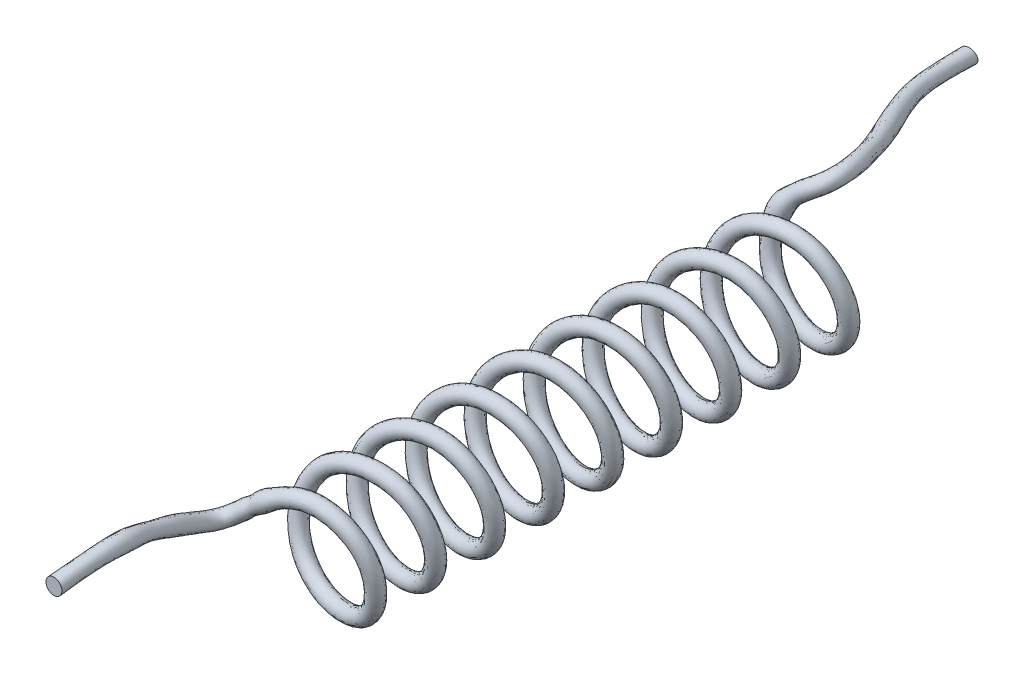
SolidWorks part; units mm, degrees
ref_plane "Plan de face" through (0, 0, 0) normal (0, 0, 1) x (1, 0, 0)
ref_plane "Plan de dessus" through (0, 0, 0) normal (0, 1, 0) x (1, 0, 0)
ref_plane "Plan de droite" through (0, 0, 0) normal (1, 0, 0) x (0, 0, -1)
sketch "Esquisse1" plane through (0, 0, 0) normal (0, 0, 1) x (1, 0, 0)
  circle A0 centre (0, 0) radius 1
curve "Hélice/Spirale1"
sketch3d "Esquisse3D3"
  spline S0 degree 3 poles (-0.7071, 0.7071, 10) (-0.8797, 0.5551, 10.0436) (-1.4291, 0.0713, 10.1825) (-1.1988, 1.0091, 11.7491) (-1.2605, 0.8185, 12.7587) (-1.2966, 0.7071, 13.3488) knots 0 0 0 0 0.159969 0.509031 1 1 1 1
  spline S2 degree 3 number of poles 147 (-0.7071, 0.7071, 0) -> (-0.7071, 0.7071, 10) construction
ref_plane "Plan2" through (0, 0, 13.3488) normal (0, 0, 1) x (1, 0, 0)
sketch "Esquisse3" plane through (0, 0, 13.3488) normal (0, 0, 1) x (1, 0, 0)
  circle A0 centre (-1.2966, 0.7071) radius 0.15
sketch3d "Esquisse3D4"
  spline S0 degree 3 poles (-0.7071, 0.7071, 0) (-0.5849, 0.7998, -0.0431) (-0.1505, 1.1291, -0.1962) (-0.633, 0.8325, -1.8747) (-1.4309, 0.7069, -2.8037) (-1.3471, 0.7123, -3.76) (-1.3328, 0.7132, -3.9229) knots 0 0 0 0 0.099392 0.353323 0.889804 1 1 1 1
  spline S1 degree 3 number of poles 147 (-0.7071, 0.7071, 0) -> (-0.7071, 0.7071, 10) construction
sketch3d "Esquisse3D5"
  spline S0 degree 3 number of poles 71 (-1.2966, 0.7071, 13.3488) -> (-1.3328, 0.7132, -3.9229)
  spline S1 degree 3 poles (-987.3946, -1429.1945, -980.7629) (48.035, 66.2863, 47.7632) (-2.3414, -3.6435, 3.977) (0.8009, 9.1523, 25.3519) (-29.8022, -107.6609, 0.8937) (478.9964, 1843.6221, 623.6193) knots -3.961135 -3.961135 -3.961135 -3.961135 0.159969 0.509031 9.683063 9.683063 9.683063 9.683063 only from (-0.7071, 0.7071, 10) to (-1.2966, 0.7071, 13.3488) construction
  spline S2 degree 3 number of poles 147 (-0.7071, 0.7071, 0) -> (-0.7071, 0.7071, 10) construction
  spline S3 degree 3 poles (1348.1829, 963.7805, 1119.1844) (-53.0392, -36.9938, -34.4153) (1.4755, 2.1288, 5.4598) (-0.633, 0.8325, -1.8747) (-5.8955, 0.0039, -8.0025) (39.8391, 6.6052, -36.224) (-1823.2778, -264.7932, 776.8124) knots -2.998315 -2.998315 -2.998315 -2.998315 0.099392 0.353323 0.889804 6.039719 6.039719 6.039719 6.039719 only from (-0.7071, 0.7071, 0) to (-1.3328, 0.7132, -3.9229) construction
sweep "Balayage1" add profiles "Esquisse3" path "Esquisse3D5"
